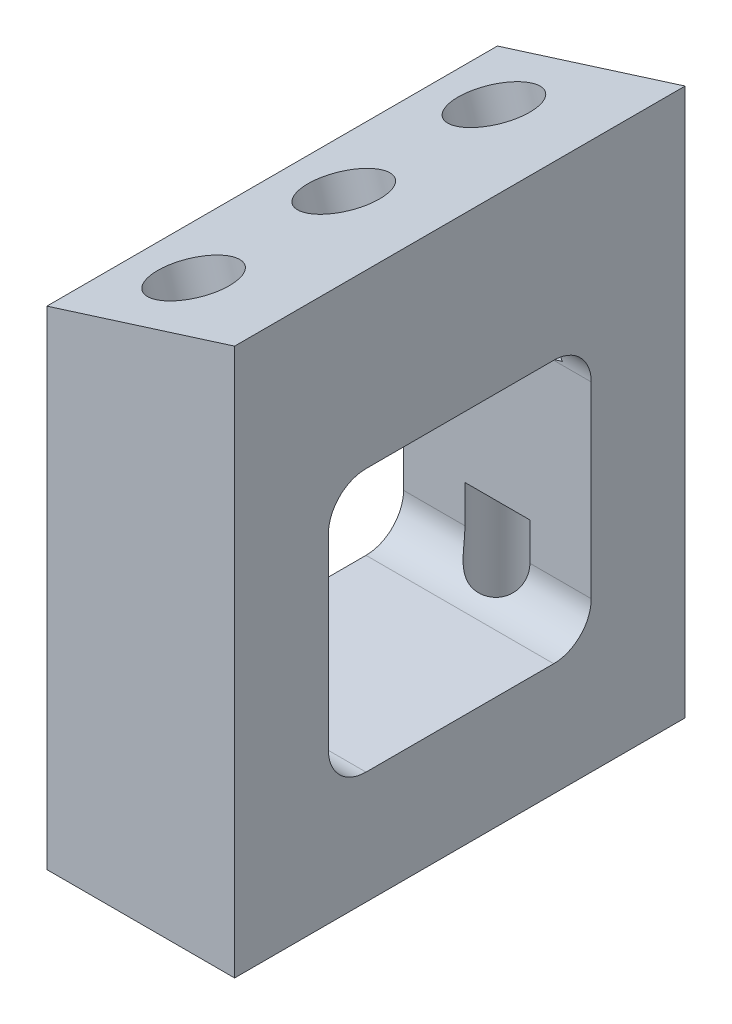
SolidWorks part; units mm, degrees
ref_plane "Front Plane" through (0, 0, 0) normal (0, 0, 1) x (1, 0, 0)
ref_plane "Top Plane" through (0, 0, 0) normal (0, 1, 0) x (1, 0, 0)
ref_plane "Right Plane" through (0, 0, 0) normal (1, 0, 0) x (0, 0, -1)
sketch "Sketch1" plane through (0, 0, 0) normal (0, 0, 1) x (1, 0, 0)
  line L0 (0, 0) -> (7.9375, 0)
  line L1 (7.9375, 0) -> (7.9375, 46.2804)
  line L2 (7.9375, 46.2804) -> (-7.9375, 41.275)
  line L3 (-7.9375, 41.275) -> (-7.9375, 0)
  line L4 (-7.9375, 0) -> (0, 0)
  line L5 (-1.8814, 43.1845) -> (2.0827, 30.6121) construction
  dimension "D1" = 15.875
  dimension "D2" = 41.275
  dimension "D3" = 17.5
  dimension "D4" = 6.35
sketch "Sketch2" plane through (0, 0, 0) normal (0, 0, 1) x (1, 0, 0)
  line L0 (0, 0) -> (7.9375, 0) construction
  line L1 (7.9375, 0) -> (7.9375, 46.2804) construction
  line L2 (7.9375, 46.2804) -> (-7.9375, 41.275) construction
  line L3 (-7.9375, 41.275) -> (-7.9375, 0) construction
  line L4 (-7.9375, 0) -> (0, 0) construction
  line L5 (0, 0) -> (7.9375, 0)
  line L6 (7.9375, 0) -> (7.9375, 46.2804)
  line L7 (7.9375, 46.2804) -> (-7.9375, 41.275)
  line L8 (-7.9375, 41.275) -> (-7.9375, 0)
  line L9 (-7.9375, 0) -> (0, 0)
extrude "Boss-Extrude1" add sketch "Sketch2" along normal mid plane 38.1
sketch "Sketch5" plane through (0, 0, 0) normal (1, 0, 0) x (0, 0, -1)
  line L0 (0, 0) -> (0, 20.8214) construction
  line L1 (-11.1125, 9.525) -> (11.1125, 9.525)
  line L2 (11.1125, 9.525) -> (11.1125, 31.75)
  line L3 (11.1125, 31.75) -> (-11.1125, 31.75)
  line L4 (-11.1125, 31.75) -> (-11.1125, 9.525)
  dimension "D1" = 22.225
  dimension "D2" = 9.525
  dimension "D3" = 22.225
extrude "Cut-Extrude3" cut sketch "Sketch5" against normal mid plane 38.1
fillet "Fillet1" radius 3.175 4 edges at (0, 9.525, -11.1125) (0, 31.75, -11.1125) (0, 31.75, 11.1125) (0, 9.525, 11.1125)
sketch "Sketch3" plane through (-12.5549, 39.8191, 0) normal (-0.3007, 0.9537, 0) x (0.9537, 0.3007, 0)
  circle A0 centre (11.1915, 0) radius 3.175
  circle A1 centre (11.1915, -12.7) radius 3.175
  circle A2 centre (11.1915, 12.7) radius 3.175
  dimension "D1" = 6.35
  dimension "D2" = 12.7
  dimension "D3" = 12.7
extrude "Cut-Extrude1" cut sketch "Sketch3" against normal blind 15.875
sketch "Sketch4" plane through (0, 0, 0) normal (0, -1, 0) x (1, 0, 0)
  line L0 (0, 0) -> (10.9287, 0) construction
  circle A1 centre (0, 12.7) radius 3.175
  circle A2 centre (0, -12.7) radius 3.175
  dimension "D2" = 6.35
  dimension "D1" = 25.4
extrude "Cut-Extrude2" cut sketch "Sketch4" against normal blind 15.875
